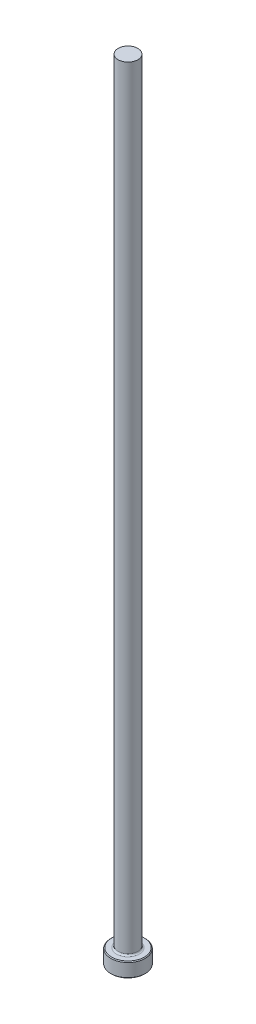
SolidWorks part; units mm, degrees
ref_plane "Front Plane" through (0, 0, 0) normal (0, 0, 1) x (1, 0, 0)
ref_plane "Top Plane" through (0, 0, 0) normal (0, 1, 0) x (1, 0, 0)
ref_plane "Right Plane" through (0, 0, 0) normal (1, 0, 0) x (0, 0, -1)
sketch "Sketch1" plane through (0, 0, 0) normal (0, 0, 1) x (1, 0, 0)
  line L0 (0, 259.9588) -> (0, -15.1925) construction
  line L1 (0, 0) -> (-5.5499, 0)
  line L2 (-5.5499, 0) -> (-5.5499, 4.7498)
  line L3 (-5.5499, 4.7498) -> (-3.175, 4.7498)
  line L4 (-3.175, 4.7498) -> (-3.175, 254)
  line L5 (-3.175, 254) -> (0, 254)
  line L6 (0, 254) -> (0, 0)
  dimension "L" = 254
  dimension "H" = 11.0998
  dimension "T" = 4.7498
  dimension "D" = 6.35
revolve "Revolve1" add sketch "Sketch1" angle 360 about L0
chamfer "Chamfer1" distance 0.254 angle 45 2 edges at (0, 4.7498, 5.5499) (0, 0, 5.5499)
fillet "Fillet1" radius 0.508 1 edges at (0, 4.7498, 3.175)
sketch "Pocket Sketch" plane through (0, 0, 0) normal (0, 0, 1) x (1, 0, 0)
  line L0 (-5.9468, 0) -> (-5.9468, 4.7752)
  line L1 (-5.9468, 4.7752) -> (-4.3339, 4.7752)
  line L2 (-3.5719, 5.5372) -> (-3.5719, 22.225)
  line L3 (-3.5719, 22.225) -> (0, 22.225)
  line L4 (0, 22.225) -> (0, 0)
  line L5 (0, 0) -> (-5.9468, 0)
  line L6 (0, 12.6104) -> (0, -2.4989) construction
  line L7 (-5.5499, 4.4958) -> (-5.5499, 0.254) construction
  line L8 (5.2959, 4.7498) -> (-5.2959, 4.7498) construction
  line L9 (-3.175, 254) -> (-3.175, 5.2578) construction
  line L10 (-4.3339, 4.7752) -> (-3.5719, 5.5372)
  point P3 (-3.5719, 4.7752)
  dimension "D1" = 11.8935
  dimension "D2" = 0.3969
  dimension "D3" = 0.0254
  dimension "D4" = 0.3969
  dimension "D5" = 7.1437
  dimension "D6" = 22.225
